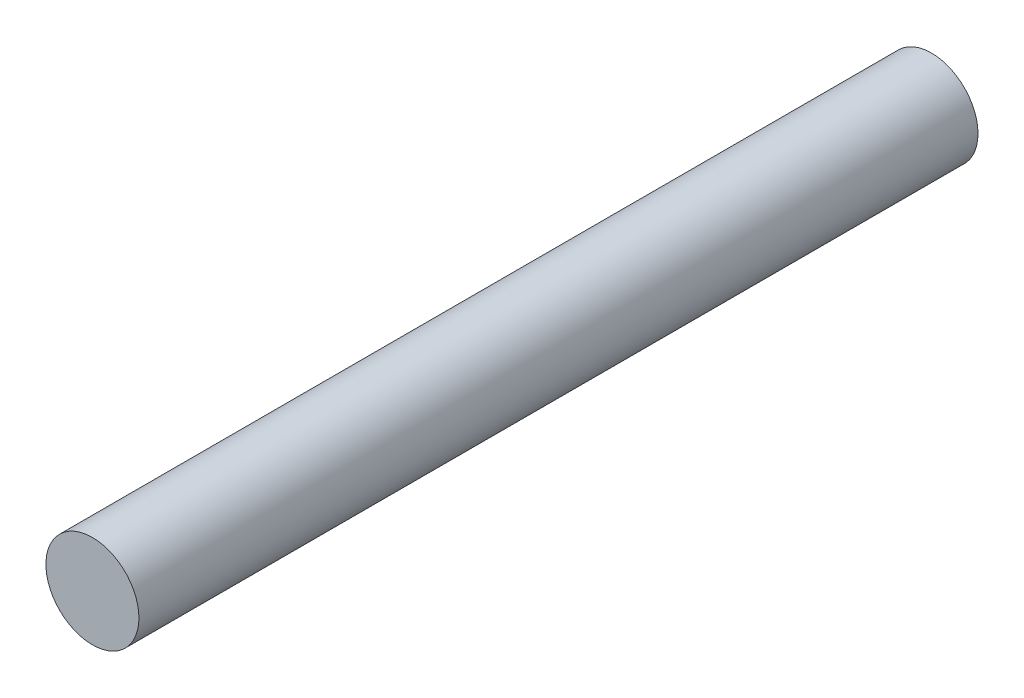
SolidWorks part; units mm, degrees
ref_plane "Front Plane" through (0, 0, 0) normal (0, 0, 1) x (1, 0, 0)
ref_plane "Top Plane" through (0, 0, 0) normal (0, 1, 0) x (1, 0, 0)
ref_plane "Right Plane" through (0, 0, 0) normal (1, 0, 0) x (0, 0, -1)
sketch "Sketch1" plane through (0, 0, 0) normal (0, 0, 1) x (1, 0, 0)
  circle A0 centre (0, 0) radius 0.6477
extrude "Boss-Extrude1" add sketch "Sketch1" along normal blind 11.684
